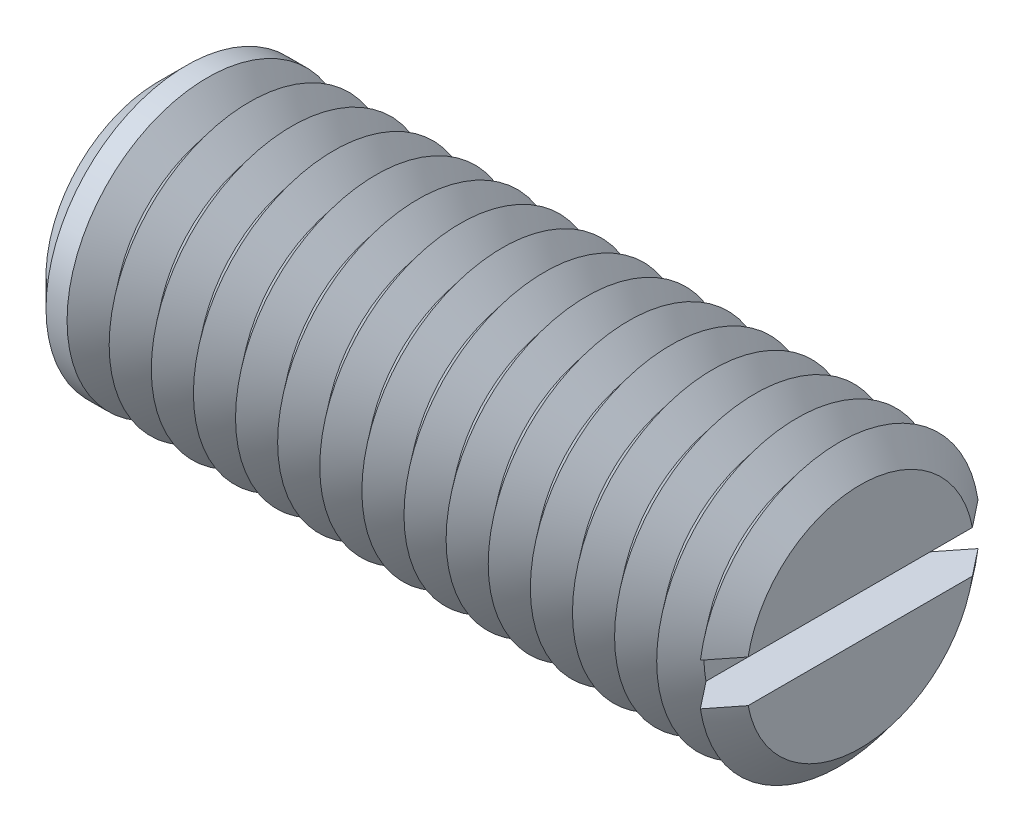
SolidWorks part; units mm, degrees
ref_plane "Front Plane" through (0, 0, 0) normal (0, 0, 1) x (1, 0, 0)
ref_plane "Top Plane" through (0, 0, 0) normal (0, 1, 0) x (1, 0, 0)
ref_plane "Right Plane" through (0, 0, 0) normal (1, 0, 0) x (0, 0, -1)
sketch "Sketch1" plane through (0, 0, 0) normal (1, 0, 0) x (0, 0, -1)
  circle A0 centre (0, 0) radius 5
  dimension "D1" = 10
extrude "Extrude1" add sketch "Sketch1" along normal mid plane 25
sketch "Sketch2" plane through (0, 0, 0) normal (0, 0, 1) x (1, 0, 0)
  line L0 (12.5, 0.75) -> (11, 0.75)
  line L1 (12.5, -5) -> (12.5, 5) construction
  line L2 (11, 0.75) -> (11, -0.75)
  line L3 (0, 0) -> (50000, 0) construction
  line L4 (12.5, -0.75) -> (11, -0.75)
  line L5 (12.5, -0.75) -> (12.5, 0.75)
  point P9 (11, 0)
  dimension "D1" = 1.5
extrude "Extrude2" cut sketch "Sketch2" against normal mid plane 15
chamfer "Chamfer1" distance 1 angle 45 1 edges at (-12.5, 0, -5)
sketch "Sketch3" plane through (0, 0, 0) normal (0, 0, 1) x (1, 0, 0)
  line L0 (0, 0) -> (30.9602, 0) construction
  line L1 (11.75, -5) -> (13.25, -5)
  line L2 (-11.5, -5) -> (12.5, -5) construction
  line L3 (13.25, -5) -> (12.5, -4.0633)
  line L4 (12.5, -5) -> (12.5, -0.75) construction
  line L5 (12.5, -4.0633) -> (11.75, -5)
  dimension "D1" = 1.5
  dimension "D2" = 1.2
revolve "Cut-Revolve1" cut sketch "Sketch3" angle 360 about L0
pattern_linear "LPattern1" count 16 spacing 1.5 along (-1, 0, 0) of "Cut-Revolve1"
equation "\"D2@Sketch3\" = \"D1@Sketch3\"*0.8"
